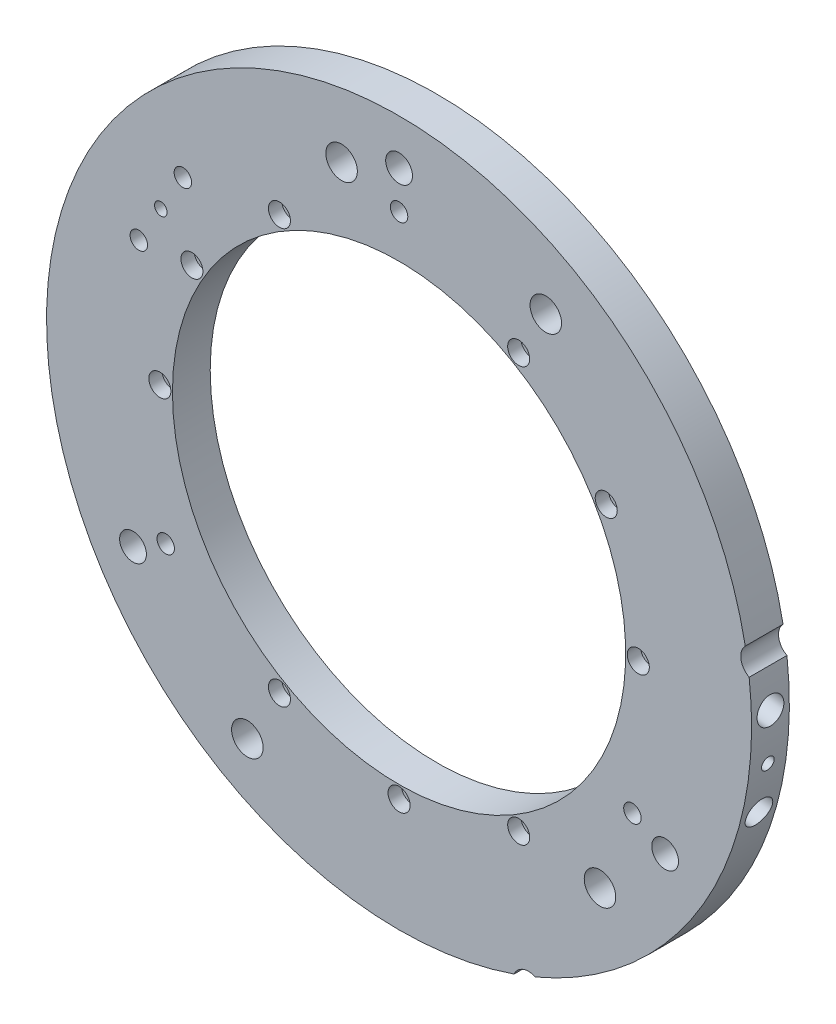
SolidWorks part; units mm, degrees
ref_plane "Front Plane" through (0, 0, 0) normal (0, 0, 1) x (1, 0, 0)
ref_plane "Top Plane" through (0, 0, 0) normal (0, 1, 0) x (1, 0, 0)
ref_plane "Right Plane" through (0, 0, 0) normal (1, 0, 0) x (0, 0, -1)
sketch "Sketch1" plane through (0, 0, 0) normal (0, 0, 1) x (1, 0, 0)
  circle A0 centre (0, 0) radius 88.9
  circle A1 centre (0, 0) radius 57.15
  dimension "D1" = 177.8
  dimension "D2" = 114.3
extrude "Boss-Extrude1" add sketch "Sketch1" along normal blind 9.525
sketch "Sketch2" plane through (0, 0, 9.525) normal (0, 0, 1) x (1, 0, 0)
  circle A0 centre (0, 77.47) radius 3.3782
  circle A1 centre (67.091, -38.735) radius 3.3782
  circle A2 centre (-67.091, -38.735) radius 3.3782
  point P10 (0, 0)
  dimension "D1" = 6.7564
  dimension "D2" = 77.47
  dimension "D3" = 3
extrude "Cut-Extrude1" cut sketch "Sketch2" against normal through all
sketch "Sketch3" plane through (0, 0, 9.525) normal (0, 0, 1) x (1, 0, 0)
  line L0 (0, 0) -> (0, -101.4014) construction
  line L1 (-30.1625, -52.243) -> (0, 0) construction
  line L2 (0, 0) -> (30.1625, -52.243) construction
  circle A0 centre (0, 0) radius 60.325 construction
  circle A1 centre (0, -60.325) radius 1.4732
  circle A2 centre (-30.1625, -52.243) radius 1.4732
  circle A3 centre (30.1625, -52.243) radius 1.4732
  circle A4 centre (-30.1625, 52.243) radius 1.4732
  circle A5 centre (-52.243, 30.1625) radius 1.4732
  circle A6 centre (-60.325, 0) radius 1.4732
  circle A7 centre (60.325, 0) radius 1.4732
  circle A8 centre (52.243, 30.1625) radius 1.4732
  circle A9 centre (30.1625, 52.243) radius 1.4732
  point P25 (0, 0)
  dimension "D1" = 120.65
  dimension "D4" = 2.9464
  dimension "D5" = 2.9464
  dimension "D6" = 2.9464
  dimension "D2" = 30
  dimension "D3" = 30
  dimension "D7" = 3
extrude "Cut-Extrude2" cut sketch "Sketch3" against normal through all
sketch "Sketch5" plane through (0, 0, 9.525) normal (0, 0, 1) x (1, 0, 0)
  circle A0 centre (-30.1625, -52.243) radius 2.7781
  circle A1 centre (0, -60.325) radius 2.7781
  circle A2 centre (30.1625, -52.243) radius 2.7781
  circle A3 centre (-30.1625, 52.243) radius 2.7781
  circle A4 centre (-52.243, 30.1625) radius 2.7781
  circle A5 centre (-60.325, 0) radius 2.7781
  circle A6 centre (60.325, 0) radius 2.7781
  circle A7 centre (52.243, 30.1625) radius 2.7781
  circle A8 centre (30.1625, 52.243) radius 2.7781
  point P23 (0, 0)
  dimension "D1" = 5.5562
  dimension "D2" = 5.5562
  dimension "D3" = 5.5562
  dimension "D4" = 3
extrude "Cut-Extrude4" cut sketch "Sketch5" against normal blind 3.3528
sketch "Sketch7" plane through (0, 0, 9.525) normal (0, 0, 1) x (1, 0, 0)
  circle A0 centre (0, 0) radius 67.945 construction
  circle A1 centre (0, 67.945) radius 2.1971
  circle A2 centre (58.8421, -33.9725) radius 2.1971
  circle A3 centre (-58.8421, -33.9725) radius 2.1971
  point P11 (0, 0)
  dimension "D1" = 135.89
  dimension "D2" = 4.3942
  dimension "D3" = 3
extrude "Cut-Extrude6" cut sketch "Sketch7" against normal through all
sketch "Sketch8" plane through (0, 0, 9.525) normal (0, 0, 1) x (1, 0, 0)
  circle A0 centre (0, 0) radius 63.5 construction
  dimension "D1" = 127
sketch "Sketch10" plane through (0, 0, 0) normal (0, 0, -1) x (-1, 0, 0)
  circle A0 centre (-37.0005, 64.0868) radius 3.9751
  circle A1 centre (14.4941, 71.4917) radius 3.9751
  circle A2 centre (-50.6693, -54.402) radius 3.9751
  circle A3 centre (38.2551, -66.2598) radius 3.9751
  circle A4 centre (-32.6662, -85.5842) radius 3.9751
  circle A5 centre (-90.1337, 13.9524) radius 3.9751
extrude "Cut-Extrude7" cut sketch "Sketch10" against normal through all
sketch "Sketch11" plane through (0, 0, 0) normal (0, 0, -1) x (-1, 0, 0)
  circle A0 centre (-77.2324, -6.0021) radius 1.6156
  circle A1 centre (1.9931, -78.9971) radius 3.2235
sketch "Sketch12" plane through (0, 0, 0) normal (0, 0, 1) x (1, 0, 0)
  line L0 (-137.041, 16.8265) -> (137.041, -16.8265)
  line L1 (-123.9704, 0) -> (123.9704, 0)
  point P5 (0, 0)
  point P8 (0, 0)
ref_plane "Plane1" through (0, 0, 0) normal (-0.1219, -0.9925, 0) x (0.9925, -0.1219, 0)
ref_plane "Plane2" through (88.2374, -10.8342, 0) normal (0.9925, -0.1219, 0) x (-0.1219, -0.9925, 0)
sketch "Sketch15" plane through (88.2374, -10.8342, 0) normal (0.9925, -0.1219, 0) x (-0.1219, -0.9925, 0)
  line L0 (0, 0) -> (0, -9.525) construction
  circle A1 centre (11.9126, -4.7625) radius 3.3782
  circle A2 centre (-11.9126, -4.7625) radius 3.3782
  dimension "D2" = 11.9126
  dimension "D3" = 6.7564
  dimension "D1" = 9.525
extrude "Cut-Extrude8" cut sketch "Sketch15" against normal blind 19.05
sketch "Sketch16" plane through (88.2374, -10.8342, 0) normal (0.9925, -0.1219, 0) x (-0.1219, -0.9925, 0)
  line L0 (11.9126, -4.7625) -> (-11.9126, -4.7625) construction
  circle A0 centre (0, -4.7625) radius 1.5875
  dimension "D1" = 3.175
extrude "Cut-Extrude9" cut sketch "Sketch16" against normal blind 6.35
sketch "Sketch17" plane through (0, 0, 9.525) normal (0, 0, 1) x (1, 0, 0)
  line L0 (-245.3956, 0) -> (270.9474, 0) construction
  line L1 (-181.8031, -216.6645) -> (181.8031, 216.6645)
  point P7 (0, 0)
  dimension "D1" = 130
ref_plane "Plane3" through (-57.1438, -68.1014, 0) normal (-0.6428, -0.766, 0) x (-0.766, 0.6428, 0)
sketch "Sketch18" plane through (-57.1438, -68.1014, 0) normal (-0.6428, -0.766, 0) x (-0.766, 0.6428, 0)
  line L0 (88.9, 0) -> (-76.2361, 0) construction
  circle A0 centre (0, -4.7625) radius 1.5875
  dimension "D2" = 3.175
  dimension "D1" = 4.7625
extrude "Cut-Extrude10" cut sketch "Sketch18" against normal blind 6.35
sketch "Sketch19" plane through (-57.1438, -68.1014, 0) normal (-0.6428, -0.766, 0) x (-0.766, 0.6428, 0)
  line L0 (88.9, 0) -> (-76.2361, 0) construction
  line L1 (0, -9.4926) -> (0, 15.6389) construction
  circle A0 centre (-11.9126, -4.7625) radius 3.3782
  circle A1 centre (0, -4.7625) radius 1.5875 construction
  circle A2 centre (11.9126, -4.7625) radius 3.3782
  dimension "D1" = 4.7625
  dimension "D2" = 6.7564
  dimension "D3" = 11.9126
extrude "Cut-Extrude12" cut sketch "Sketch19" against normal blind 19.05 contours A2
sketch "Sketch20" plane through (-57.1438, -68.1014, 0) normal (-0.6428, -0.766, 0) x (-0.766, 0.6428, 0)
  line L0 (88.9, 0) -> (-76.2361, 0) construction
  circle A0 centre (-11.9126, -4.7625) radius 3.3782
  circle A1 centre (0, -4.7625) radius 1.5875 construction
  dimension "D1" = 11.9126
  dimension "D2" = 6.7564
  dimension "D3" = 4.7625
extrude "Cut-Extrude13" cut sketch "Sketch20" against normal blind 9.525
sketch "Sketch21" plane through (0, 0, 9.525) normal (0, 0, 1) x (1, 0, 0)
  circle A0 centre (-54.5183, 48.1656) radius 2.1971
  circle A1 centre (-65.6308, 28.9182) radius 2.1971
  dimension "D1" = 4.3942
  dimension "D2" = 4.3942
extrude "Cut-Extrude14" cut sketch "Sketch21" against normal through all
sketch "Sketch22" plane through (0, 0, 9.525) normal (0, 0, 1) x (1, 0, 0)
  circle A0 centre (-60.0745, 38.5419) radius 1.5875
  dimension "D1" = 3.175
extrude "Cut-Extrude15" cut sketch "Sketch22" against normal blind 6.35
equation "\"ANGLE\"=7"
equation "\"D1@Sketch12\"=\"ANGLE\""
